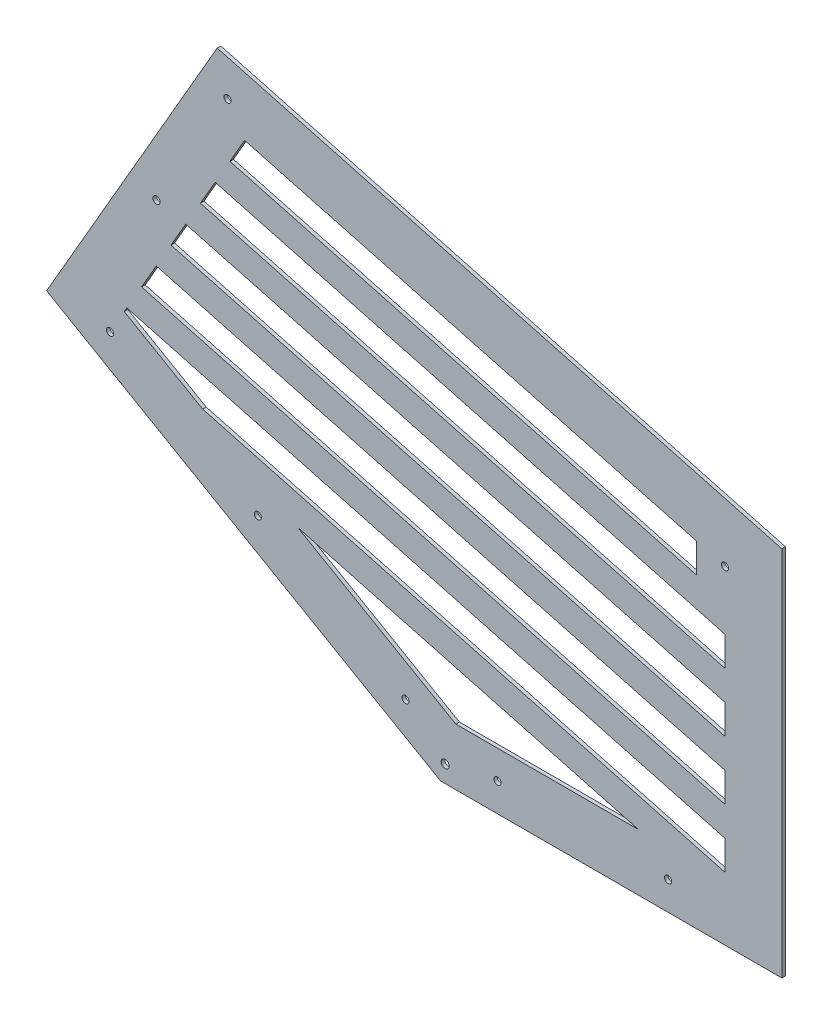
SolidWorks part; units mm, degrees
ref_plane "정면" through (0, 0, 0) normal (0, 0, 1) x (1, 0, 0)
ref_plane "윗면" through (0, 0, 0) normal (0, 1, 0) x (1, 0, 0)
ref_plane "우측면" through (0, 0, 0) normal (1, 0, 0) x (0, 0, -1)
sketch "스케치1" plane through (0, 0, 0) normal (0, 0, 1) x (1, 0, 0)
  line L5 (0, 0) -> (152.4, 0)
  line L12 (152.4, 166.0118) -> (-99.7764, 233.5823)
  line L13 (0, 0) -> (-175.9764, 101.6)
  line L16 (-175.9764, 101.6) -> (-99.7764, 233.5823)
  line L17 (152.4, 0) -> (152.4, 166.0118)
  line L19 (-87.5244, 204.0033) -> (-94.0984, 192.6168)
  line L20 (-141.2793, 110.897) -> (-106.3015, 90.7026)
  line L21 (6.8059, 25.4) -> (88.3421, 25.4)
  line L22 (127, 28.1896) -> (127, 41.3377)
  line L28 (-94.0984, 192.6168) -> (114.3, 136.7767)
  line L30 (-107.2464, 169.8438) -> (127, 107.0777)
  line L31 (-113.8204, 158.4573) -> (127, 93.9297)
  line L32 (-100.6724, 181.2303) -> (127, 120.2257)
  line L33 (-120.3944, 147.0708) -> (127, 80.7817)
  line L34 (-133.5424, 124.2978) -> (127, 54.4857)
  line L35 (-126.9684, 135.6843) -> (127, 67.6337)
  line L36 (-140.1164, 112.9113) -> (127, 41.3377)
  line L37 (-106.3015, 90.7026) -> (127, 28.1896)
  line L38 (-63.8065, 66.1681) -> (88.3421, 25.4)
  line L39 (-100.6724, 181.2303) -> (-107.2464, 169.8438)
  line L41 (127, 107.0777) -> (127, 120.2257)
  line L42 (127, 80.7817) -> (127, 93.9297)
  line L43 (127, 54.4857) -> (127, 67.6337)
  line L44 (-63.8065, 66.1681) -> (6.8059, 25.4)
  line L45 (-140.1164, 112.9113) -> (-141.2793, 110.897)
  line L46 (-126.9684, 135.6843) -> (-133.5424, 124.2978)
  line L47 (-113.8204, 158.4573) -> (-120.3944, 147.0708)
  line L49 (114.3, 149.9247) -> (114.3, 136.7767)
  line L50 (114.3, 149.9247) -> (-87.5244, 204.0033)
  circle A0 centre (2.0418, 7.62) radius 1.7859
  circle A3 centre (101.6, 12.7) radius 1.5875
  circle A4 centre (25.4, 12.7) radius 1.5875
  circle A5 centre (-147.6293, 99.8985) radius 1.5875
  circle A6 centre (-81.6382, 61.7985) radius 1.5875
  circle A7 centre (-15.647, 23.6985) radius 1.5875
  circle A8 centre (-95.1278, 216.2337) radius 1.5875
  circle A9 centre (-126.8778, 161.2411) radius 1.5875
  circle A10 centre (127, 146.5217) radius 1.5875
  dimension "D4" = 152.4
  dimension "D10" = 3.5719
  dimension "D13" = 90
  dimension "D15" = 25.4
  dimension "D16" = 25.4
  dimension "D28" = 3.175
  dimension "D29" = 3.175
  dimension "D30" = 3.175
  dimension "D31" = 3.175
  dimension "D32" = 3.175
  dimension "D33" = 25.4
  dimension "D34" = 12.7
  dimension "D36" = 3.175
  dimension "D37" = 3.175
  dimension "D41" = 25.4
  dimension "D20" = 3.175
  dimension "D2" = 203.2
  dimension "D5" = 50.8
  dimension "D6" = 90
  dimension "D7" = 150
  dimension "D8" = 105
  dimension "D9" = 127
  dimension "D11" = 7.62
  dimension "D12" = 7.62
  dimension "D14" = 105
  dimension "D17" = 101.6
  dimension "D18" = 177.8
  dimension "D19" = 25.4
  dimension "D22" = 25.4
  dimension "D23" = 12.7
  dimension "D24" = 12.7
  dimension "D25" = 12.7
  dimension "D26" = 12.7
  dimension "D27" = 12.7
  dimension "D35" = 12.7
  dimension "D38" = 76.2
  dimension "D39" = 139.7
  dimension "D40" = 25.4
  dimension "D42" = 152.4
  dimension "D44" = 12.7
  dimension "D45" = 12.7
  dimension "D46" = 12.7
  dimension "D47" = 12.7
  dimension "D48" = 12.7
  dimension "D49" = 12.7
  dimension "D50" = 12.7
  dimension "D51" = 12.7
  dimension "D52" = 12.7
extrude "보스-돌출1" add sketch "스케치1" along normal blind 1.5875
